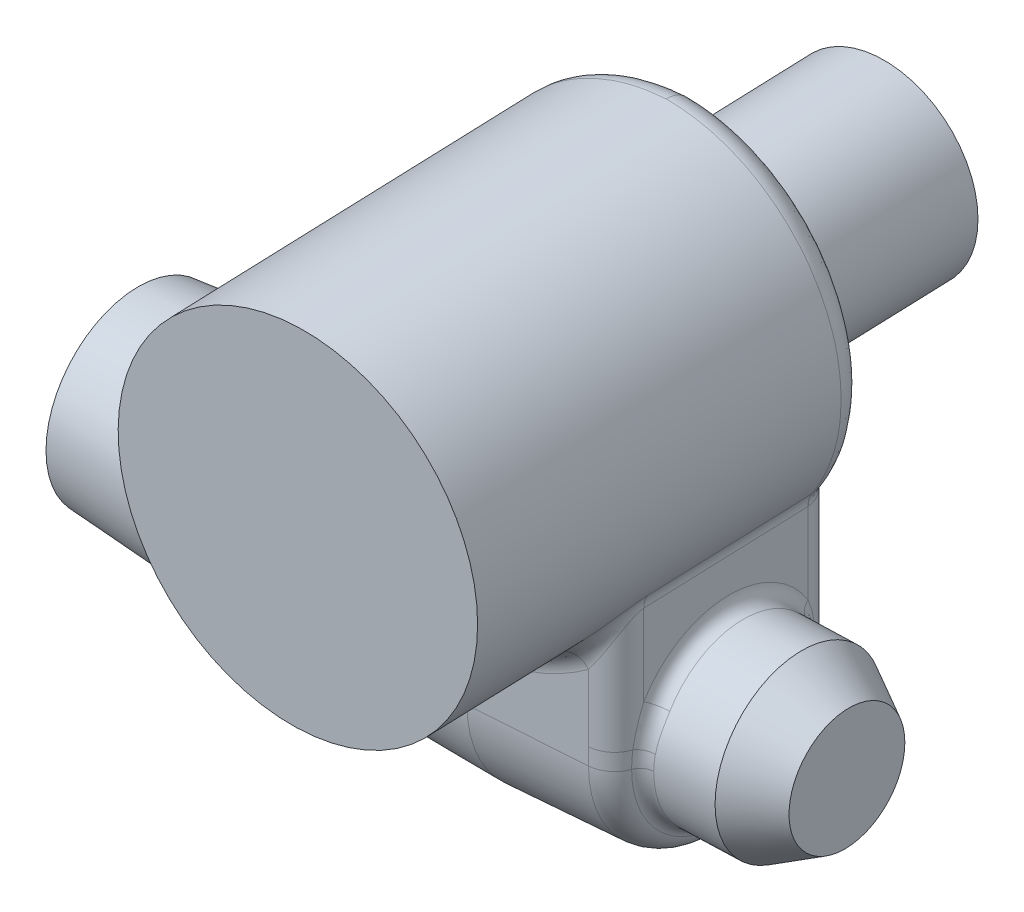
SolidWorks part; units mm, degrees
ref_plane "Plan de face" through (0, 0, 0) normal (0, 0, 1) x (1, 0, 0)
ref_plane "Plan de dessus" through (0, 0, 0) normal (0, 1, 0) x (1, 0, 0)
ref_plane "Plan de droite" through (0, 0, 0) normal (1, 0, 0) x (0, 0, -1)
surface "Surface-Cousue1"
ref_plane "Plan4" through (0.8427, 0, 24.1311) normal (0.0349, 0, 0.9994) x (0.9994, 0, -0.0349)
sketch "Esquisse2" plane through (0.8427, 0, 24.1311) normal (0.0349, 0, 0.9994) x (0.9994, 0, -0.0349)
  arc A0 (0.2205, -36.7747) -> (0.2205, 37.9728) centre (0.2205, 0.599) ccw construction
  arc A1 (0.2205, 37.9728) -> (0.2205, -36.7747) centre (0.2205, 0.599) ccw construction
  arc A2 (0.2205, -36.7747) -> (0.2205, 37.9728) centre (0.2205, 0.599) ccw
  arc A3 (0.2205, 37.9728) -> (0.2205, -36.7747) centre (0.2205, 0.599) ccw
surface "Surface-Extrusion1" sketch "Esquisse2"
surface "Surface-Plan1"
surface "Surface-Plan2"
surface "Surface-Plan3"
ref_plane "Plan5" through (-3.6943, 0, -105.7898) normal (0.0349, 0, 0.9994) x (0.9994, 0, -0.0349)
sketch "Esquisse3" plane through (-3.6943, 0, -105.7898) normal (0.0349, 0, 0.9994) x (0.9994, 0, -0.0349)
  arc A0 (0.2205, 20.801) -> (0.2205, -19.603) centre (0.2205, 0.599) ccw construction
  arc A1 (0.2205, -19.603) -> (0.2205, 20.801) centre (0.2205, 0.599) ccw construction
  arc A2 (0.2205, 20.801) -> (0.2205, -19.603) centre (0.2205, 0.599) ccw
  arc A3 (0.2205, -19.603) -> (0.2205, 20.801) centre (0.2205, 0.599) ccw
surface "Surface-Extrusion2" sketch "Esquisse3"
surface "Surface-Plan4"
surface "Surface-Cousue2"
sketch "Esquisse4" plane through (45.6472, 0, -1.594) normal (0.9994, 0, -0.0349) x (-0.0349, 0, -0.9994)
  circle A0 centre (38.8251, -51.9262) radius 18.6869 construction
  circle A1 centre (38.8251, -51.9262) radius 18.6869
extrude "Extrusion1" add sketch "Esquisse4" along normal blind 10 draft 30
sketch "Esquisse5" plane through (-52.2729, 0, 1.8254) normal (-0.9994, 0, 0.0349) x (0.0349, 0, 0.9994)
  circle A0 centre (-38.8251, -51.9262) radius 23.4183 construction
  circle A1 centre (-38.8251, -51.9262) radius 23.4183
extrude "Extrusion2" add sketch "Esquisse5" along normal blind 40 draft 5
